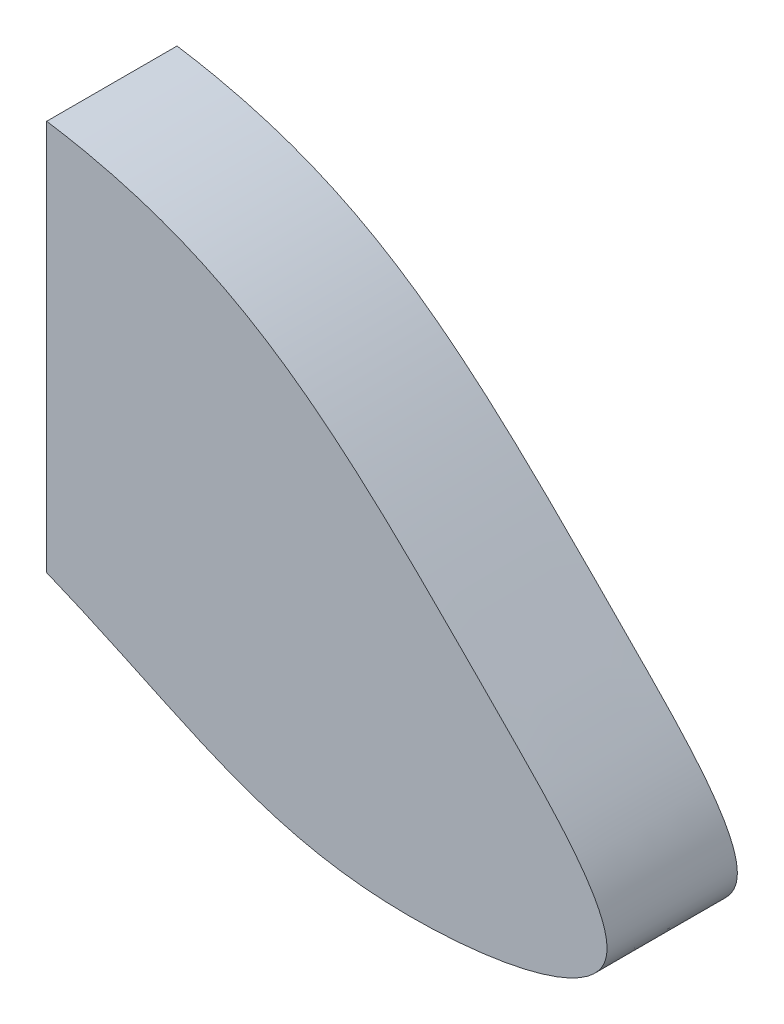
SolidWorks part; units mm, degrees
ref_plane "Alzado" through (0, 0, 0) normal (0, 0, 1) x (1, 0, 0)
ref_plane "Planta" through (0, 0, 0) normal (0, 1, 0) x (1, 0, 0)
ref_plane "Vista lateral" through (0, 0, 0) normal (1, 0, 0) x (0, 0, -1)
sketch "Croquis1" plane through (0, 0, 0) normal (0, 0, 1) x (1, 0, 0)
  line L0 (0, 0) -> (0, 18)
  spline S0 degree 3 poles (0, 18) (9.4022, 16.5392) (15.138, 10.4448) (29.4153, -3.9053) (11.5437, -6.7805) (6.3211, -2.5668) (0, 0) knots 0 0 0 0 0.415073 0.555976 0.71259 1 1 1 1
  point P4 (16.578, -5.3418)
  point P6 (0, 0)
  dimension "D1" = 18
extrude "Saliente-Extruir1" add sketch "Croquis1" along normal blind 6
